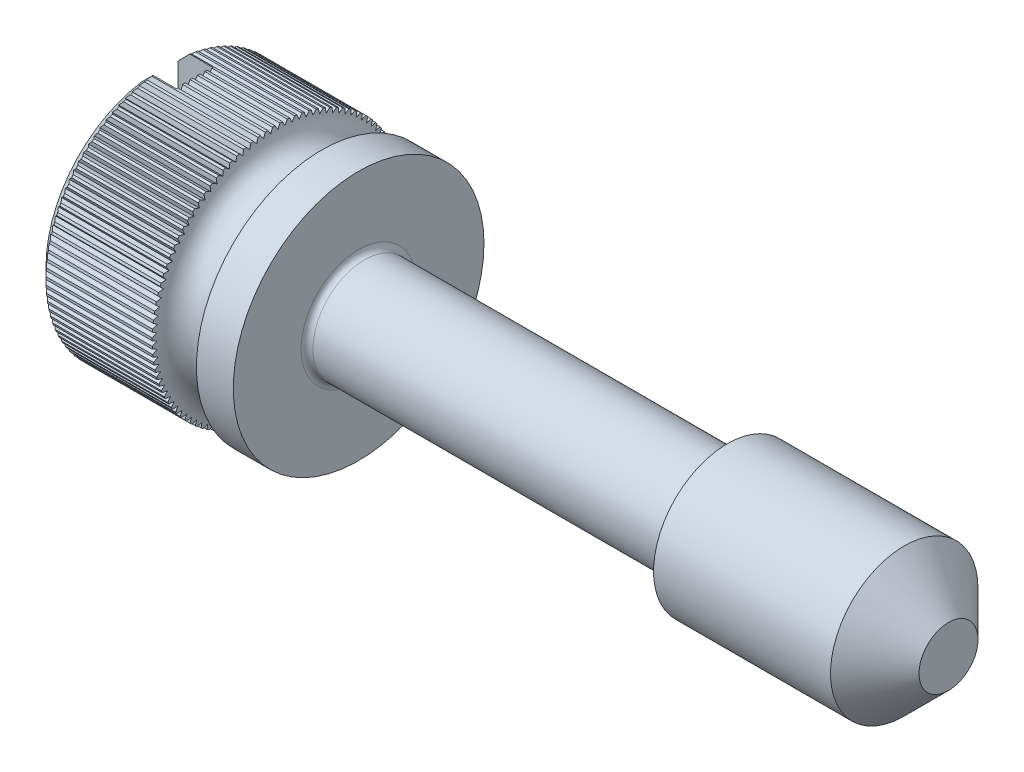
SolidWorks part; units mm, degrees
ref_plane "Front" through (0, 0, 0) normal (0, 0, 1) x (1, 0, 0)
ref_plane "Top" through (0, 0, 0) normal (0, 1, 0) x (1, 0, 0)
ref_plane "Right" through (0, 0, 0) normal (1, 0, 0) x (0, 0, -1)
other "Configuration Table"
sketch "Sketch1" plane through (0, 0, 0) normal (1, 0, 0) x (0, 0, -1)
  circle A0 centre (0, 0) radius 8.5
extrude "BaseHead" add sketch "Sketch1" along normal blind 13.5
sketch "Sketch2" plane through (12.6635, 0, 1.1635) normal (0, 1, 0) x (0, 0, 1)
  line L0 (7.3365, -1.6635) -> (10.3365, -1.6635)
  line L1 (7.3365, -4.6635) -> (10.3365, -4.6635)
  line L2 (10.3365, -4.6635) -> (10.3365, -1.6635)
  line L3 (7.3365, -12.6635) -> (7.3365, 0.8365) construction
  line L4 (7.3365, 0.8365) -> (-9.6635, 0.8365) construction
  line L5 (-1.1635, 4.9919) -> (-1.1635, -18.8189) construction
  arc A0 (7.3365, -1.6635) -> (7.3365, -4.6635) centre (7.3365, -3.1635) ccw
  dimension "db" = 3
  dimension "h" = 2.5
  dimension "D3" = 3
revolve "Cut-Revolve1" cut sketch "Sketch2" angle 360 about L5
chamfer "Chamfer1" distance 0.8 angle 45 1 edges at (0, 0, -8.5)
sketch "Sketch3" plane through (0, 0, 0) normal (1, 0, 0) x (0, 0, -1)
  line L1 (0, 8.2113) -> (0.25, 8.6443)
  line L2 (0.25, 8.6443) -> (-0.25, 8.6443)
  line L3 (-0.25, 8.6443) -> (0, 8.2113)
  circle A0 centre (0, 8.5) radius 0.1443 construction
  circle A2 centre (0, 0) radius 8.5 construction
  dimension "D1" = 0.5
extrude "Cut-Extrude1" cut sketch "Sketch3" along normal up to next
pattern_circular "CircularPattern1" count 107 over 360 about axis through (0, 0, 0) along (1, 0, 0) of "Cut-Extrude1"
sketch "Sketch4" plane through (13.5, 4.4852, -2.1504) normal (1, 0, 0) x (0, 0, -1)
  circle A0 centre (-2.1504, -4.4852) radius 3.5
  circle A1 centre (-2.1504, -4.4852) radius 8.5 construction
  dimension "d1" = 7
extrude "BaseBody" add sketch "Sketch4" along normal blind 40
sketch "Sketch5" plane through (53.5, -0.8575, -1.49) normal (1, 0, 0) x (0, 0, -1)
  circle A0 centre (-1.49, 0.8575) radius 5
  circle A1 centre (-1.49, 0.8575) radius 3.5 construction
extrude "BaseEnd" add sketch "Sketch5" against normal blind 15
chamfer "Chamfer2" distance 3 angle 45 1 edges at (53.5, 0, -5)
fillet "Fillet1" radius 0.4 2 edges at (38.5, 0, -3.5) (13.5, 0, -3.5)
sketch "Sketch6" plane through (-10.163, 0, -10.163) normal (0, 1, 0) x (0, 0, 1)
  line L0 (2.463, 10.163) -> (17.863, 10.163) construction
  line L1 (8.913, 12.563) -> (11.413, 12.563)
  line L2 (8.913, 12.563) -> (8.913, 5.163)
  line L3 (8.913, 5.163) -> (11.413, 5.163)
  line L4 (11.413, 12.563) -> (11.413, 5.163)
  line L5 (10.163, 42.947) -> (10.163, -22.621) construction
  dimension "n" = 2.5
  dimension "t" = 2.4
  dimension "D3" = 5
extrude "Cut-Extrude2" cut sketch "Sketch6" against normal through all and the other way through all
sketch "Sketch7" plane through (0, 0, 0) normal (0, 0, 1) x (1, 0, 0)
  line L0 (38.5, 3.9175) -> (39.125, 5)
  line L1 (39.125, 5) -> (39.125, 6.25)
  line L2 (39.125, 6.25) -> (37.875, 6.25)
  line L3 (37.875, 6.25) -> (37.875, 5)
  line L4 (37.875, 5) -> (38.5, 3.9175)
  line L5 (38.5, 5) -> (38.5, -5) construction
  line L6 (0, 0) -> (41.5302, 0) construction
revolve "Cut-Revolve10" [suppressed] cut sketch "Sketch7" angle 360 about L6
pattern_linear "LPattern10" [suppressed] count 10 spacing 1.5 along (1, 0, 0)
equation "\"D1@CircularPattern1\" =  int( \"dk@Sketch1\" * PI / 0.5 + 1  ) "
equation "\"D1@Sketch7\" = \"d@Sketch5\""
equation "\"D2@Sketch7\" =  ( \"d@Sketch5\" - \"THD_MINOR@ThreadCosmetic1\" )  / 2"
equation "\"D3@LPattern10\" = \"D2@Sketch7\" * 1.2"
equation "\"D1@LPattern10\" = \"b@BaseEnd\" / \"D3@LPattern10\""
